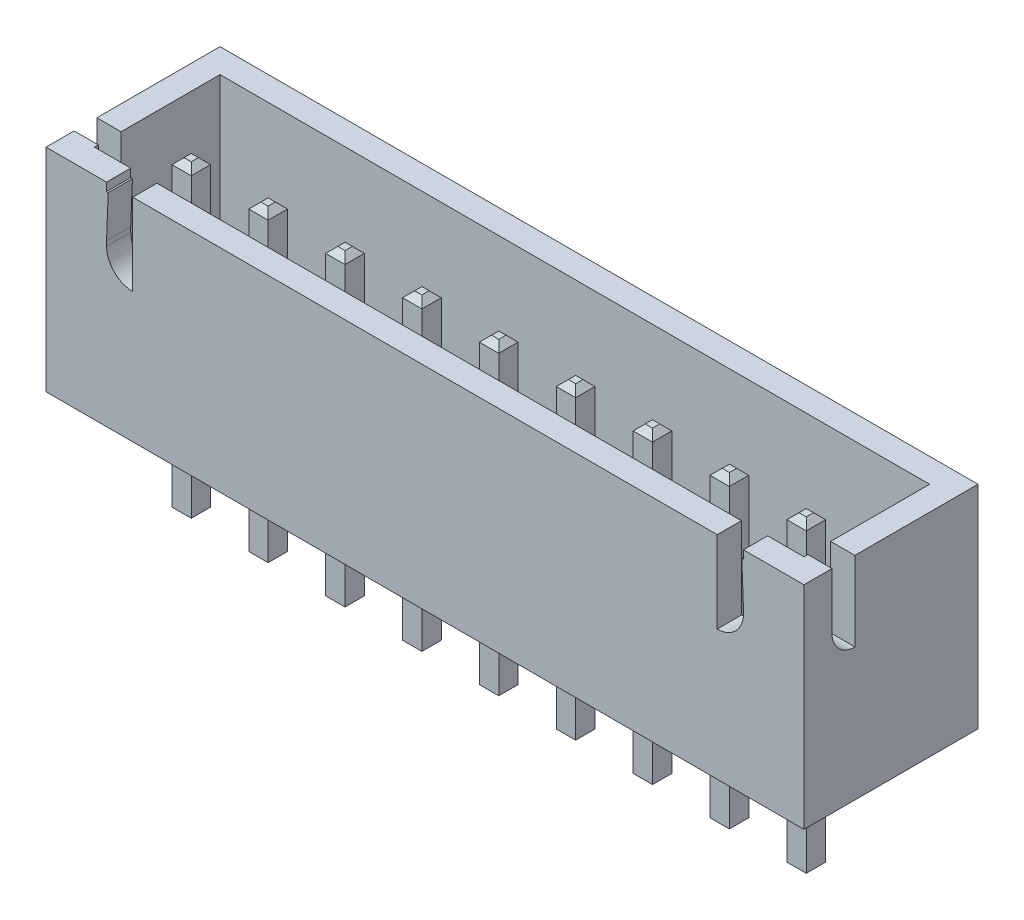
SolidWorks part; units mm, degrees
other "Camera1"
ref_plane "Front Plane" through (0, 0, 0) normal (0, 0, 1) x (1, 0, 0)
ref_plane "Top Plane" through (0, 0, 0) normal (0, 1, 0) x (1, 0, 0)
ref_plane "Right Plane" through (0, 0, 0) normal (1, 0, 0) x (0, 0, -1)
sketch "Sketch1" plane through (0, 0, 0) normal (0, 1, 0) x (1, 0, 0)
  line L1 (-12.5222, 2.875) -> (12.5222, 2.875)
  line L2 (-12.5222, 2.875) -> (-12.5222, -2.875)
  line L3 (-12.5222, -2.875) -> (12.5222, -2.875)
  line L4 (12.5222, 2.875) -> (12.5222, -2.875)
  line L5 (-12.5222, 2.875) -> (12.5222, -2.875) construction
  line L6 (-12.5222, -2.875) -> (12.5222, 2.875) construction
  point P0 (0, 0)
  dimension "D1" = 5.75
  dimension "D2" = 25.0444
extrude "Boss-Extrude1" add sketch "Sketch1" along normal blind 7
shell "Shell1" thickness 0.8
sketch "Sketch2" plane through (12.5222, 0, 0) normal (1, 0, 0) x (0, 0, -1)
  line L0 (-1.193, 7) -> (-1.193, 4.3796)
  line L1 (-2.875, 7) -> (2.875, 7) construction
  line L2 (-1.9469, 5.1335) -> (-1.9469, 7)
  line L3 (-1.9469, 7) -> (-1.193, 7)
  arc A0 (-1.193, 4.3796) -> (-1.9469, 5.1335) centre (-1.193, 5.1335) cw
extrude "Cut-Extrude1" cut sketch "Sketch2" against normal through all
sketch "Sketch3" plane through (0, 0, 2.875) normal (0, 0, 1) x (1, 0, 0)
  line L0 (-10.5222, 7) -> (-10.5222, 6.7289)
  line L1 (-12.5222, 7) -> (12.5222, 7) construction
  line L2 (-10.5222, 6.7289) -> (-10.4671, 6.7268)
  line L3 (-10.4671, 6.7268) -> (-10.5222, 5.3183)
  line L4 (-10.5222, 5.3183) -> (-10.5222, 5.1663)
  line L5 (-9.656, 4.3001) -> (-9.656, 7)
  line L6 (-9.656, 7) -> (-10.5222, 7)
  line L7 (-12.5222, 7) -> (-12.5222, 0) construction
  line L8 (0, 7) -> (0, 0) construction
  line L9 (9.656, 7) -> (10.5222, 7)
  line L10 (9.656, 4.3001) -> (9.656, 7)
  line L11 (10.5222, 5.3183) -> (10.5222, 5.1663)
  line L12 (10.4671, 6.7268) -> (10.5222, 5.3183)
  line L13 (10.5222, 6.7289) -> (10.4671, 6.7268)
  line L14 (10.5222, 7) -> (10.5222, 6.7289)
  arc A0 (-10.5222, 5.1663) -> (-9.656, 4.3001) centre (-9.656, 5.1663) ccw
  arc A1 (10.5222, 5.1663) -> (9.656, 4.3001) centre (9.656, 5.1663) cw
  point P23 (-10.5222, 2.7343)
  point P24 (0, 0)
  point P25 (-10.5222, 5.3183)
  dimension "D1" = 2
extrude "Cut-Extrude2" cut sketch "Sketch3" against normal up to next
sketch "Sketch4" plane through (0, 0, 0) normal (0, -1, 0) x (1, 0, 0)
  line L0 (-12.5222, -2.875) -> (-12.5222, 2.875) construction
  line L1 (-10.3922, 0.845) -> (-9.7522, 0.845)
  line L2 (-10.3922, 0.845) -> (-10.3922, 0.205)
  line L3 (-10.3922, 0.205) -> (-9.7522, 0.205)
  line L4 (-9.7522, 0.845) -> (-9.7522, 0.205)
  line L5 (-10.3922, 0.845) -> (-9.7522, 0.205) construction
  line L6 (-10.3922, 0.205) -> (-9.7522, 0.845) construction
  line L7 (-7.8522, 0.205) -> (-7.2122, 0.205)
  line L8 (-7.2122, 0.845) -> (-7.2122, 0.205)
  line L9 (-12.5222, 2.875) -> (12.5222, 2.875) construction
  line L10 (-7.8522, 0.845) -> (-7.2122, 0.845)
  line L11 (-7.8522, 0.845) -> (-7.8522, 0.205)
  line L12 (-5.3122, 0.205) -> (-4.6722, 0.205)
  line L13 (-4.6722, 0.845) -> (-4.6722, 0.205)
  line L14 (-5.3122, 0.845) -> (-4.6722, 0.845)
  line L15 (-5.3122, 0.845) -> (-5.3122, 0.205)
  line L16 (-2.7722, 0.205) -> (-2.1322, 0.205)
  line L17 (-2.1322, 0.845) -> (-2.1322, 0.205)
  line L18 (-2.7722, 0.845) -> (-2.1322, 0.845)
  line L19 (-2.7722, 0.845) -> (-2.7722, 0.205)
  line L20 (-0.2322, 0.205) -> (0.4078, 0.205)
  line L21 (0.4078, 0.845) -> (0.4078, 0.205)
  line L22 (-0.2322, 0.845) -> (0.4078, 0.845)
  line L23 (-0.2322, 0.845) -> (-0.2322, 0.205)
  line L24 (2.3078, 0.205) -> (2.9478, 0.205)
  line L25 (2.9478, 0.845) -> (2.9478, 0.205)
  line L26 (2.3078, 0.845) -> (2.9478, 0.845)
  line L27 (2.3078, 0.845) -> (2.3078, 0.205)
  line L28 (4.8478, 0.205) -> (5.4878, 0.205)
  line L29 (5.4878, 0.845) -> (5.4878, 0.205)
  line L30 (4.8478, 0.845) -> (5.4878, 0.845)
  line L31 (4.8478, 0.845) -> (4.8478, 0.205)
  line L32 (7.3878, 0.205) -> (8.0278, 0.205)
  line L33 (8.0278, 0.845) -> (8.0278, 0.205)
  line L34 (7.3878, 0.845) -> (8.0278, 0.845)
  line L35 (7.3878, 0.845) -> (7.3878, 0.205)
  line L36 (9.9278, 0.205) -> (10.5678, 0.205)
  line L37 (10.5678, 0.845) -> (10.5678, 0.205)
  line L38 (9.9278, 0.845) -> (10.5678, 0.845)
  line L39 (9.9278, 0.845) -> (9.9278, 0.205)
  point P0 (-10.0722, 0.525)
  dimension "D1" = 0.64
  dimension "D2" = 0.64
  dimension "D3" = 2.45
  dimension "D4" = 2.35
  dimension "D5" = 9
extrude "Boss-Extrude2" add sketch "Sketch4" along normal blind 3.45 and the other way blind 6.75
chamfer "Chamfer1" distance 0.2 angle 45 72 edges at (-10.0722, -3.45, 0.205) (-10.3922, -3.45, 0.525) (-10.0722, -3.45, 0.845) (-9.7522, -3.45, 0.525) (-10.0722, 6.75, 0.845) (-10.3922, 6.75, 0.525) (-10.0722, 6.75, 0.205) (-9.7522, 6.75, 0.525) (10.2478, 6.75, 0.845) (9.9278, 6.75, 0.525) (10.2478, 6.75, 0.205) (10.5678, 6.75, 0.525) (7.7078, 6.75, 0.845) (7.3878, 6.75, 0.525) (7.7078, 6.75, 0.205) (8.0278, 6.75, 0.525) (5.1678, 6.75, 0.845) (4.8478, 6.75, 0.525) (5.1678, 6.75, 0.205) (5.4878, 6.75, 0.525) (2.6278, 6.75, 0.845) (2.3078, 6.75, 0.525) (2.6278, 6.75, 0.205) (2.9478, 6.75, 0.525) (0.0878, 6.75, 0.845) (-0.2322, 6.75, 0.525) (0.0878, 6.75, 0.205) (0.4078, 6.75, 0.525) (-2.4522, 6.75, 0.845) (-2.7722, 6.75, 0.525) (-2.4522, 6.75, 0.205) (-2.1322, 6.75, 0.525) (-4.9922, 6.75, 0.845) (-5.3122, 6.75, 0.525) (-4.9922, 6.75, 0.205) (-4.6722, 6.75, 0.525) (-7.5322, 6.75, 0.845) (-7.8522, 6.75, 0.525) (-7.5322, 6.75, 0.205) (-7.2122, 6.75, 0.525) (-7.5322, -3.45, 0.205) (-7.8522, -3.45, 0.525) (-7.5322, -3.45, 0.845) (-7.2122, -3.45, 0.525) (-4.9922, -3.45, 0.205) (-5.3122, -3.45, 0.525) (-4.9922, -3.45, 0.845) (-4.6722, -3.45, 0.525) (-2.4522, -3.45, 0.205) (-2.7722, -3.45, 0.525) (-2.4522, -3.45, 0.845) (-2.1322, -3.45, 0.525) (0.0878, -3.45, 0.205) (-0.2322, -3.45, 0.525) (0.0878, -3.45, 0.845) (0.4078, -3.45, 0.525) (2.6278, -3.45, 0.205) (2.3078, -3.45, 0.525) (2.6278, -3.45, 0.845) (2.9478, -3.45, 0.525) (5.1678, -3.45, 0.205) (4.8478, -3.45, 0.525) (5.1678, -3.45, 0.845) (5.4878, -3.45, 0.525) (10.2478, -3.45, 0.205) (9.9278, -3.45, 0.525) (10.2478, -3.45, 0.845) (10.5678, -3.45, 0.525) (7.7078, -3.45, 0.205) (7.3878, -3.45, 0.525) (7.7078, -3.45, 0.845) (8.0278, -3.45, 0.525)
